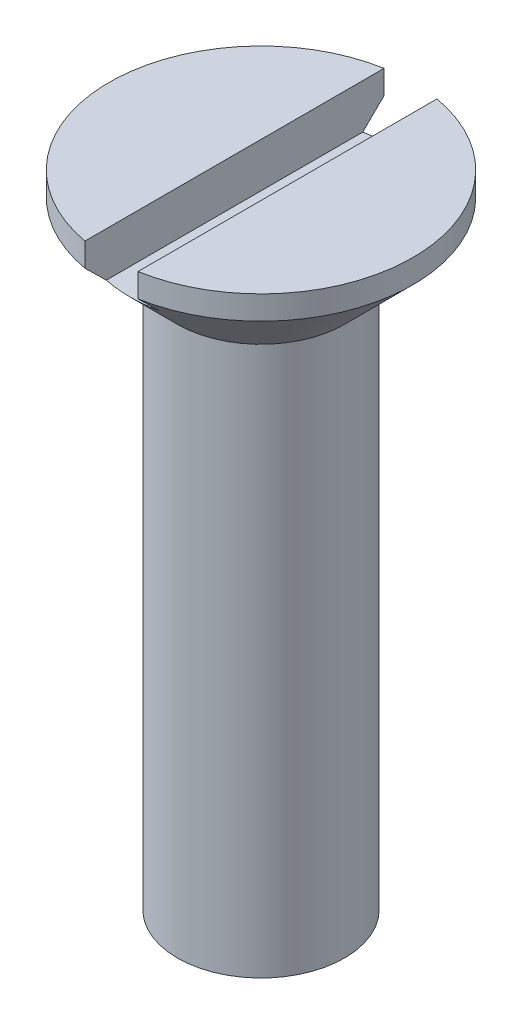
SolidWorks part; units mm, degrees
ref_plane "Front Plane" through (0, 0, 0) normal (0, 0, 1) x (1, 0, 0)
ref_plane "Top Plane" through (0, 0, 0) normal (0, 1, 0) x (1, 0, 0)
ref_plane "Right Plane" through (0, 0, 0) normal (1, 0, 0) x (0, 0, -1)
sketch "Sketch1" plane through (0, 0, 0) normal (0, 0, 1) x (1, 0, 0)
  line L0 (0, 0) -> (0, 24.7321)
  line L1 (0, 24.7321) -> (5.45, 24.7321)
  line L2 (5.45, 23.8821) -> (3, 21.4321)
  line L3 (3, 21.4321) -> (3, 1.7321)
  line L4 (3, 1.7321) -> (0, 0)
  line L5 (0, 30.1235) -> (0, -5.1382) construction
  line L6 (-3, 21.4321) -> (-5.45, 23.8821) construction
  line L8 (5.45, 24.7321) -> (5.45, 23.8821)
  line L9 (5.45, 30.1235) -> (5.45, -5.1382) construction
  dimension "D1" = 6
  dimension "D2" = 23
  dimension "D3" = 3.3
  dimension "D4" = 90
  dimension "D5" = 120
  dimension "D6" = 10.9
revolve "Revolve1" add sketch "Sketch1" angle 360 about L5
sketch "Sketch2" plane through (0, 0, 0) normal (0, 0, 1) x (1, 0, 0)
  line L0 (0, -0.9967) -> (0, 26.645) construction
  line L1 (6.3, 24.7321) -> (-6.3, 24.7321) construction
  line L2 (-0.95, 24.7321) -> (0.95, 24.7321)
  line L3 (-0.95, 24.7321) -> (-0.95, 23.1321)
  line L4 (-0.95, 23.1321) -> (0.95, 23.1321)
  line L5 (0.95, 24.7321) -> (0.95, 23.1321)
  dimension "D1" = 1.9
  dimension "D2" = 1.6
extrude "Cut-Extrude2" cut sketch "Sketch2" against normal mid plane 12
